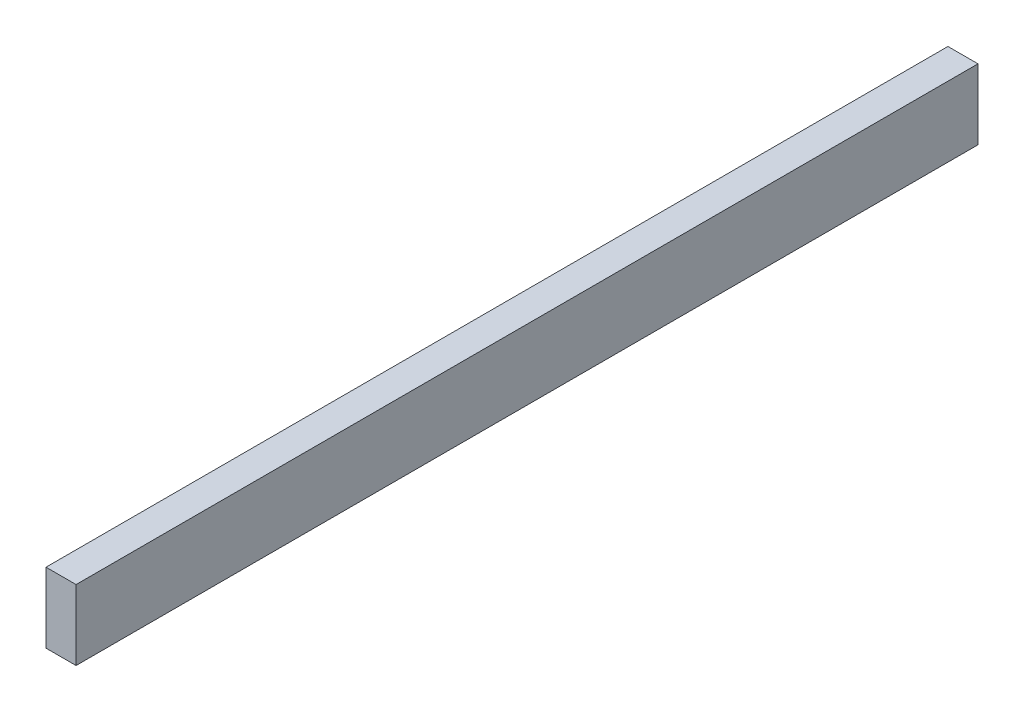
SolidWorks part; units mm, degrees
ref_plane "Front Plane" through (0, 0, 0) normal (0, 0, 1) x (1, 0, 0)
ref_plane "Top Plane" through (0, 0, 0) normal (0, 1, 0) x (1, 0, 0)
ref_plane "Right Plane" through (0, 0, 0) normal (1, 0, 0) x (0, 0, -1)
sketch "Sketch1" plane through (0, 0, 0) normal (0, 0, 1) x (1, 0, 0)
  line L1 (-19.05, -44.45) -> (19.05, -44.45)
  line L2 (-19.05, -44.45) -> (-19.05, 44.45)
  line L3 (-19.05, 44.45) -> (19.05, 44.45)
  line L4 (19.05, -44.45) -> (19.05, 44.45)
  line L5 (-19.05, -44.45) -> (19.05, 44.45) construction
  line L6 (-19.05, 44.45) -> (19.05, -44.45) construction
  point P0 (0, 0)
  dimension "D1" = 38.1
  dimension "D2" = 88.9
extrude "Boss-Extrude1" add sketch "Sketch1" against normal blind 1143 contours L4 L3 L2 L1
